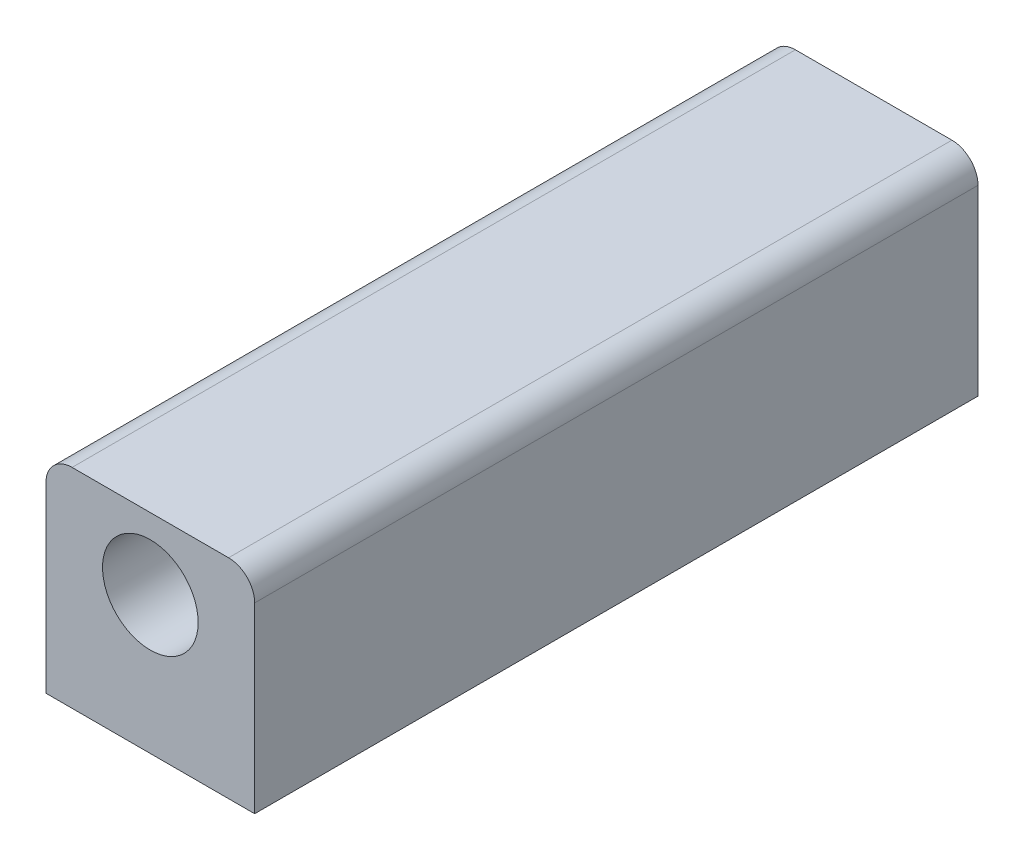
SolidWorks part; units mm, degrees
ref_plane "Front Plane" through (0, 0, 0) normal (0, 0, 1) x (1, 0, 0)
ref_plane "Top Plane" through (0, 0, 0) normal (0, 1, 0) x (1, 0, 0)
ref_plane "Right Plane" through (0, 0, 0) normal (1, 0, 0) x (0, 0, -1)
sketch "Sketch1" plane through (0, 0, 0) normal (0, 0, 1) x (1, 0, 0)
  line L3 (-9, 8.2) -> (9, 8.2)
  line L4 (-12, 5.2) -> (-12, -15.8)
  line L5 (-12, -15.8) -> (12, -15.8)
  line L6 (12, 5.2) -> (12, -15.8)
  circle A0 centre (0, 0) radius 5.5
  arc A1 (9, 8.2) -> (12, 5.2) centre (9, 5.2) cw
  arc A2 (-9, 8.2) -> (-12, 5.2) centre (-9, 5.2) ccw
  point P3 (12, 8.2)
  dimension "D3" = 11
  dimension "D4" = 3
  dimension "D5" = 3
  dimension "D1" = 24
  dimension "D2" = 24
  dimension "D6" = 15.8
  dimension "D7" = 12
extrude "Boss-Extrude2" add sketch "Sketch1" along normal blind 83.2
